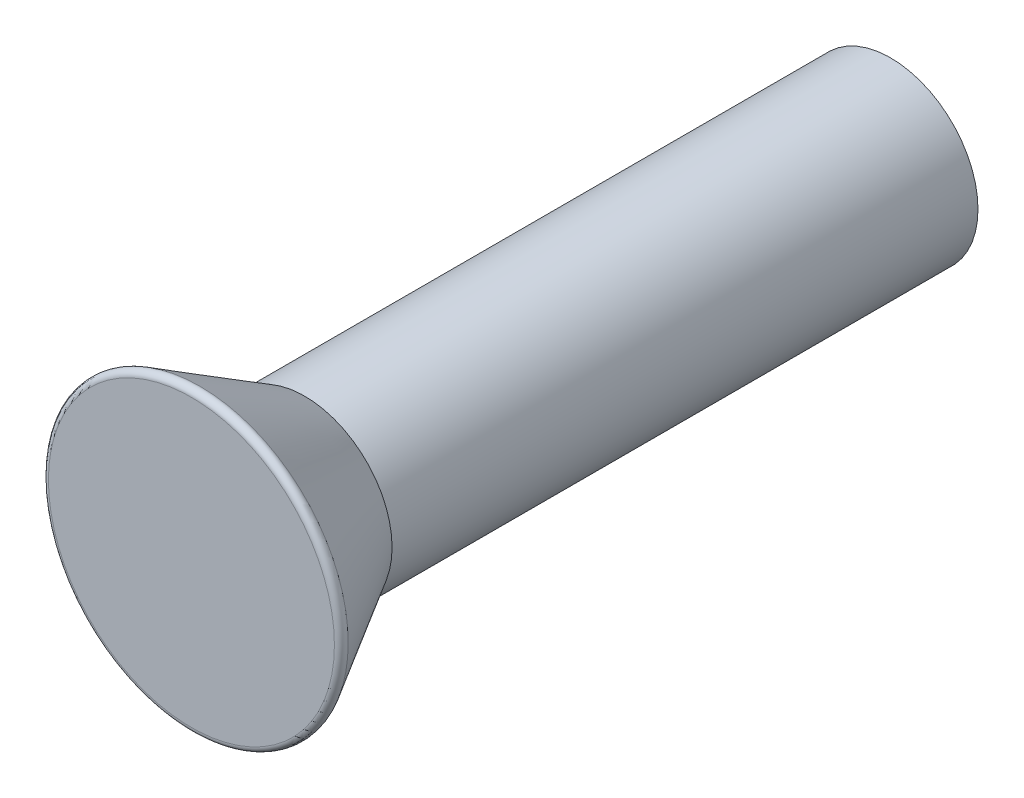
SolidWorks part; units mm, degrees
ref_plane "Front Plane" through (0, 0, 0) normal (0, 0, 1) x (1, 0, 0)
ref_plane "Top Plane" through (0, 0, 0) normal (0, 1, 0) x (1, 0, 0)
ref_plane "Right Plane" through (0, 0, 0) normal (1, 0, 0) x (0, 0, -1)
sketch "BaseBodySke" plane through (0, 0, 0) normal (0, 1, 0) x (1, 0, 0)
  line L0 (0, 0) -> (-5.5626, 0)
  line L1 (0, 0) -> (0, 32.7778) construction
  line L2 (0, 0) -> (0, 25.4)
  line L3 (0, 25.4) -> (-3.175, 25.4)
  line L4 (-3.175, 4.1148) -> (-3.175, 25.4)
  line L5 (-5.5626, 25.4) -> (-5.5626, 0) construction
  line L6 (-5.5626, -4.1148) -> (-5.5626, 0) construction
  line L7 (-5.5626, 0) -> (-3.175, 4.1148)
  line L9 (-3.175, 4.1148) -> (-3.175, 0) construction
  dimension "Diameter" = 6.35
  dimension "Head_Diameter" = 11.1252
  dimension "Length" = 25.4
  dimension "Head_Depth" = 4.1148
revolve "BaseBody" add sketch "BaseBodySke" angle 360 about L1
fillet "Fillet" radius 0.2117 1 edges at (5.5626, 0, 0)
equation "\"D1@Fillet\" = \"Diameter@BaseBodySke\" / 30"
